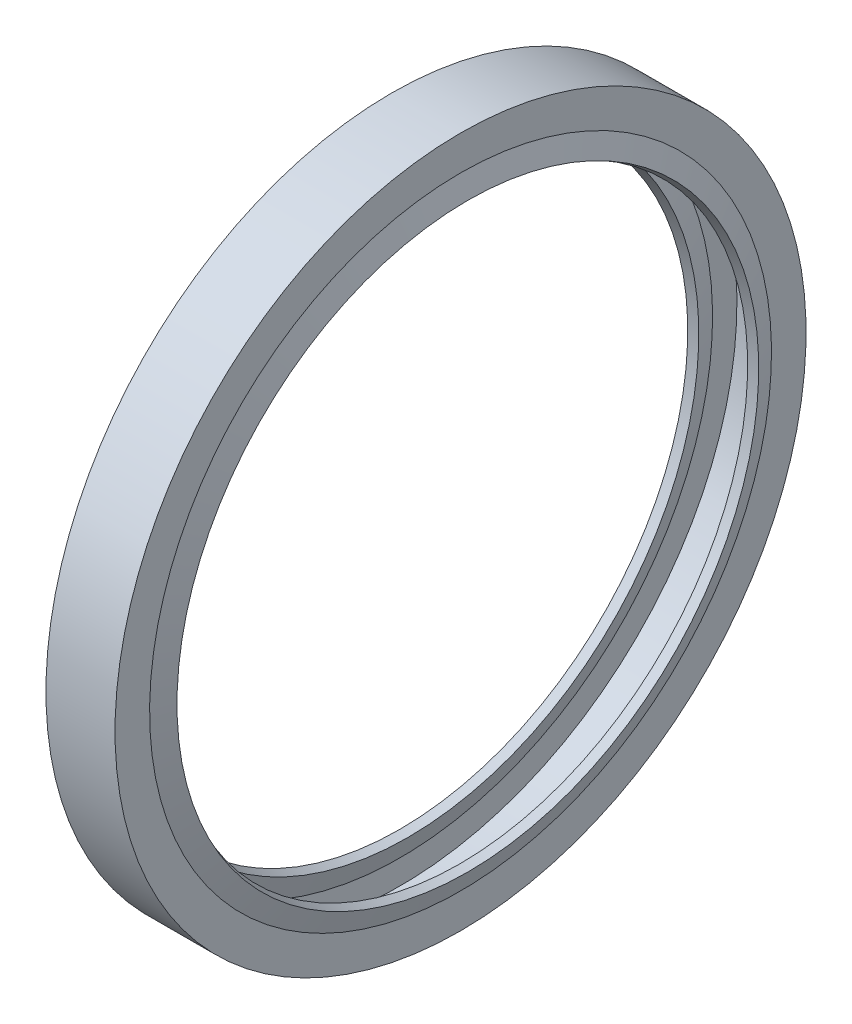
SolidWorks part; units mm, degrees
ref_plane "Face" through (0, 0, 0) normal (0, 0, 1) x (1, 0, 0)
ref_plane "Cote" through (0, 0, 0) normal (0, 1, 0) x (1, 0, 0)
ref_plane "Dessus" through (0, 0, 0) normal (1, 0, 0) x (0, 0, -1)
sketch "Esquisse1" plane through (0, 0, 0) normal (0, 0, 1) x (1, 0, 0)
  line L0 (0, 0) -> (-26.7224, 0) construction
  line L1 (-20.8246, 60) -> (-20.8246, 54)
  line L2 (-20.8246, 60) -> (-8.8246, 60)
  line L3 (-8.8246, 60) -> (-8.8246, 54)
  line L4 (-8.8246, 54) -> (-7.5554, 50.513)
  line L5 (-20.8246, 54) -> (-19.3687, 50)
  line L6 (-19.3687, 50) -> (-17.9592, 50.513)
  line L7 (-17.9592, 50.513) -> (-19.3246, 54.2645)
  line L8 (-19.3246, 54.2645) -> (-19.3246, 58.5)
  line L9 (-19.3246, 58.5) -> (-10.3246, 58.5)
  line L10 (-10.3246, 58.5) -> (-10.3246, 53.7355)
  line L11 (-10.3246, 53.7355) -> (-8.965, 50)
  line L12 (-8.965, 50) -> (-7.5554, 50.513)
  dimension "D1" = 1.5
  dimension "D2" = 1.5
  dimension "D3" = 1.5
  dimension "D4" = 1.5
  dimension "D5" = 1.5
  dimension "D6" = 120
  dimension "D7" = 100
  dimension "D8" = 100
  dimension "D9" = 12
  dimension "D10" = 160
  dimension "D12" = 108
  dimension "D13" = 108
revolve "Révolution1" add sketch "Esquisse1" angle 360 about L0
